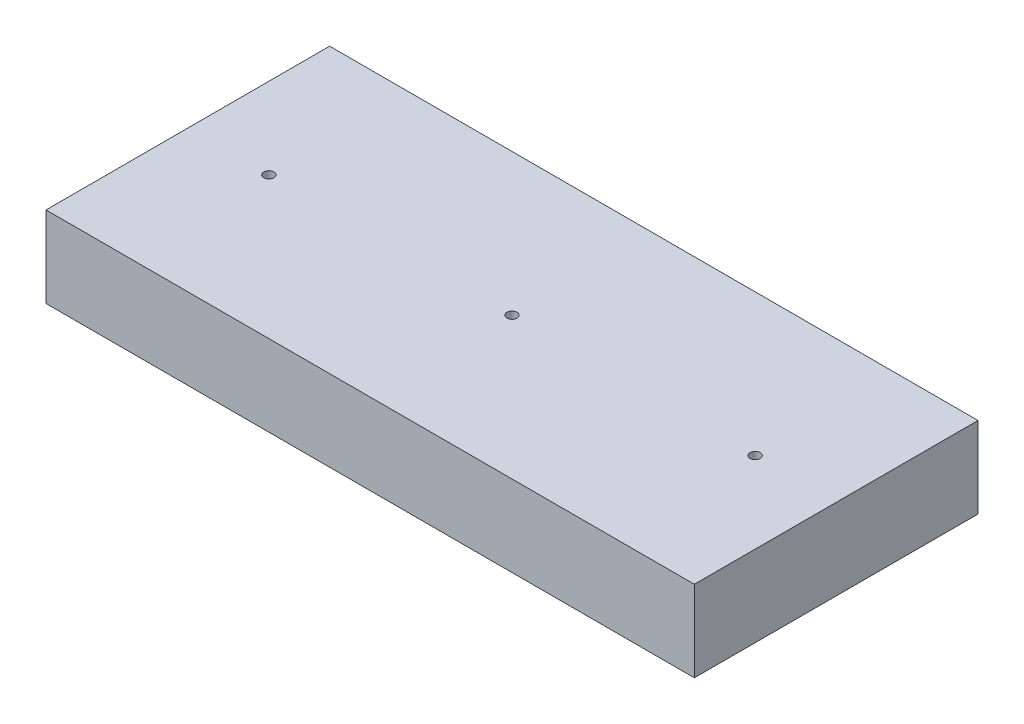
SolidWorks part; units mm, degrees
ref_plane "Front Plane" through (0, 0, 0) normal (0, 0, 1) x (1, 0, 0)
ref_plane "Top Plane" through (0, 0, 0) normal (0, 1, 0) x (1, 0, 0)
ref_plane "Right Plane" through (0, 0, 0) normal (1, 0, 0) x (0, 0, -1)
sketch "Sketch1" plane through (0, 0, 0) normal (0, 1, 0) x (1, 0, 0)
  line L0 (-101.6, -44.45) -> (101.6, 44.45) construction
  line L1 (-101.6, 44.45) -> (101.6, 44.45)
  line L2 (-101.6, 44.45) -> (-101.6, -44.45)
  line L3 (-101.6, -44.45) -> (101.6, -44.45)
  line L4 (101.6, 44.45) -> (101.6, -44.45)
  dimension "D1" = 203.2
  dimension "D2" = 88.9
extrude "Boss-Extrude1" add sketch "Sketch1" along normal blind 25.4
sketch "Sketch2" plane through (0, 0, 0) normal (0, -1, 0) x (1, 0, 0)
  line L0 (76.2, 0) -> (-76.2, 0) construction
  line L1 (101.6, 44.45) -> (101.6, -44.45) construction
  circle A0 centre (76.2, 0) radius 1.5875
  circle A1 centre (-76.2, 0) radius 1.5875
  circle A2 centre (0, 0) radius 1.5875
  dimension "D1" = 25.4
  dimension "D2" = 3.175
extrude "Cut-Extrude1" cut sketch "Sketch2" against normal through all
